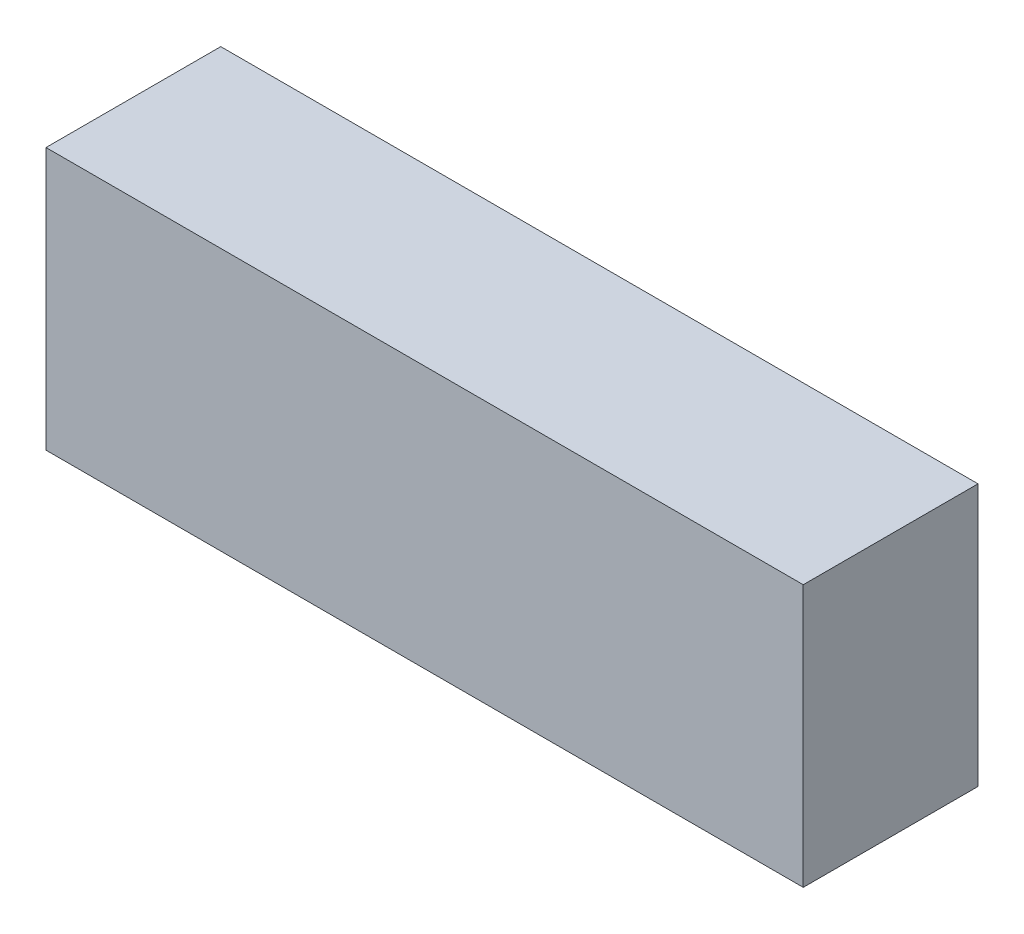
SolidWorks part; units mm, degrees
ref_plane "Plan de face" through (0, 0, 0) normal (0, 0, 1) x (1, 0, 0)
ref_plane "Plan de dessus" through (0, 0, 0) normal (0, 1, 0) x (1, 0, 0)
ref_plane "Plan de droite" through (0, 0, 0) normal (1, 0, 0) x (0, 0, -1)
sketch "Esquisse1" plane through (0, 0, 0) normal (0, 0, 1) x (1, 0, 0)
  line L1 (0, 0) -> (134, 0)
  line L2 (0, 0) -> (0, 50)
  line L3 (0, 50) -> (134, 50)
  line L4 (134, 0) -> (134, 50)
  dimension "D1" = 134
  dimension "D2" = 50
extrude "Extrusion1" add sketch "Esquisse1" along normal blind 30
sketch "Esquisse2" plane through (0, 50, 0) normal (0, 1, 0) x (1, 0, 0)
  line L1 (0, -30) -> (134, -30)
  line L2 (0, -30) -> (0, 0)
  line L3 (0, 0) -> (134, 0)
  line L4 (134, -30) -> (134, 0)
extrude "Enlèv. mat.-Extru.1" cut sketch "Esquisse2" against normal blind 5
sketch "Esquisse3" plane through (0, 0, 0) normal (-1, 0, 0) x (0, 0, 1)
  line L1 (30, 0) -> (0, 0)
  line L2 (30, 0) -> (30, 45)
  line L3 (30, 45) -> (0, 45)
  line L4 (0, 0) -> (0, 45)
extrude "Enlèv. mat.-Extru.2" cut sketch "Esquisse3" against normal blind 2
sketch "Esquisse4" plane through (134, 0, 0) normal (1, 0, 0) x (0, 0, -1)
  line L0 (-30, 45) -> (0, 45) construction
  line L1 (-30, 0) -> (0, 0)
  line L2 (-30, 0) -> (-30, 45)
  line L3 (-30, 45) -> (0, 45)
  line L4 (0, 0) -> (0, 45)
  line L5 (0, 0) -> (0, 45) construction
extrude "Enlèv. mat.-Extru.3" cut sketch "Esquisse4" against normal blind 2
sketch "Esquisse5" [suppressed] plane through (0, 0, 30) normal (0, 0, 1) x (1, 0, 0)
  line L0 (132, 14) -> (112, 14)
  line L1 (132, 45) -> (132, 0) construction
  line L2 (112, 14) -> (112, 0)
  line L3 (2, 0) -> (132, 0) construction
  line L4 (132, 14) -> (132, 0)
  line L5 (132, 0) -> (112, 0)
  dimension "D1" = 14
  dimension "D2" = 20
extrude "Enlèv. mat.-Extru.4" [suppressed] cut sketch "Esquisse5" against normal blind 10
fillet "Congé1" [suppressed] radius 10
sketch "Esquisse6" [suppressed] plane through (0, 0, 30) normal (0, 0, 1) x (1, 0, 0)
  line L0 (2, 19) -> (27, 19)
  line L1 (2, 0) -> (2, 45) construction
  line L2 (27, 19) -> (27, 30)
  line L3 (27, 30) -> (2, 30)
  line L4 (2, 30) -> (2, 19)
  line L5 (2, 45) -> (132, 45) construction
  dimension "D1" = 15
  dimension "D2" = 11
  dimension "D3" = 25
extrude "Enlèv. mat.-Extru.5" [suppressed] cut sketch "Esquisse6" against normal through all
fillet "Congé2" [suppressed] radius 5
fillet "Congé3" [suppressed] radius 5
hole_wizard "Diamètre du perçage Ø20.0 (20)1" positions "Esquisse8" profile "Esquisse7" hole size "Ø20.0" standard "ISO"
sketch "Esquisse8" plane through (0, 0, 30) normal (0, 0, 1) x (1, 0, 0)
  line L1 (2, 0) -> (112, 0) construction
  line L2 (2, 0) -> (2, 19) construction
  point P0 (75, 29)
  dimension "D1" = 29
  dimension "D2" = 73
sketch "Esquisse7" plane through (75, 29, 30) normal (1, 0, 0) x (0, -1, 0)
  line L0 (0, 0) -> (0, 30)
  line L1 (0, 30) -> (10, 30)
  line L2 (10, 30) -> (10, 0)
  line L5 (10, 0) -> (0, 0)
  line L11 (0, -6.35) -> (0, 107.95) construction
  dimension "Diamètre du perçage jusqu'au prochain" = 20
  dimension "Profondeur du perçage jusqu'au prochain" = 30
hole_wizard "Diamètre du perçage Ø10.0 (10)1" positions "Esquisse10" profile "Esquisse9" hole size "Ø10.0" standard "ISO"
sketch "Esquisse10" plane through (0, 0, 30) normal (0, 0, 1) x (1, 0, 0)
  line L0 (2, 0) -> (112, 0) construction
  circle A0 centre (75, 29) radius 10 construction
  point P0 (46, 29)
  point P6 (104, 29)
  dimension "D1" = 29
  dimension "D2" = 29
  dimension "D3" = 29
sketch "Esquisse9" plane through (46, 29, 30) normal (1, 0, 0) x (0, -1, 0)
  line L0 (0, 0) -> (0, 30)
  line L1 (0, 30) -> (5, 30)
  line L2 (5, 30) -> (5, 0)
  line L5 (5, 0) -> (0, 0)
  line L11 (0, -6.35) -> (0, 107.95) construction
  dimension "Diamètre du perçage jusqu'au prochain" = 10
  dimension "Profondeur du perçage jusqu'au prochain" = 30
hole_wizard "Diamètre du perçage Ø3.0 (3)1" positions "Esquisse12" profile "Esquisse11" hole size "Ø3.0" standard "ISO"
sketch "Esquisse12" plane through (0, 45, 0) normal (0, 1, 0) x (-1, 0, 0)
  line L1 (-132, 0) -> (-2, 0) construction
  line L2 (-2, 30) -> (-2, 0) construction
  point P0 (-75, 2.5)
  dimension "D1" = 73
  dimension "D2" = 2.5
sketch "Esquisse11" plane through (75, 45, 2.5) normal (1, 0, 0) x (0, 0, 1)
  line L0 (0, 0) -> (0, 40.9013)
  line L1 (0, 40.9013) -> (1.5, 40)
  line L2 (1.5, 40) -> (1.5, 0)
  line L5 (1.5, 0) -> (0, 0)
  line L10 (0, 40.9013) -> (-1.5, 40) construction
  line L11 (0, -6.35) -> (0, 107.95) construction
  dimension "Diamètre du perçage" = 3
  dimension "Profondeur du perçage" = 40
  dimension "Angle de pointe" = 118
hole_wizard "Perçage1" positions "Esquisse14" profile "Esquisse13" legacy
sketch "Esquisse14" plane through (0, 45, 0) normal (0, 1, 0) x (-1, 0, 0)
  line L0 (-2, 30) -> (-2, 0) construction
  line L1 (-132, 0) -> (-2, 0) construction
  point P0 (-35, 15)
  point P6 (-115, 15)
  dimension "D1" = 33
  dimension "D2" = 15
  dimension "D3" = 80
sketch "Esquisse13" plane through (35, 45, 15) normal (1, 0, 0) x (0, 0, 1)
  line L0 (0, 0) -> (0, 47.7039)
  line L1 (0, 47.7039) -> (4.5, 45)
  line L2 (4.5, 45) -> (4.5, 8.2)
  line L3 (4.5, 8.2) -> (7.5, 8.2)
  line L4 (7.5, 0) -> (0, 0)
  line L5 (0, -11.3109) -> (0, 121.1557) construction
  line L6 (0, 47.7039) -> (-4.5, 45) construction
  line L7 (7.5, 8.2) -> (7.5, 0)
  dimension "Diamètre" = 9
  dimension "Profondeur" = 45
  dimension "Diamètre chambrage" = 15
  dimension "Profondeur chambrage" = 8.2
  dimension "Angle" = 118
sketch "Esquisse15" [suppressed] plane through (0, 45, 0) normal (0, 1, 0) x (1, 0, 0)
  line L0 (2, -30) -> (2, 0) construction
  line L1 (106, -24.5) -> (44, -24.5)
  line L2 (106, -24.5) -> (106, -5.5)
  line L3 (106, -5.5) -> (44, -5.5)
  line L4 (44, -24.5) -> (44, -5.5)
  line L5 (132, 0) -> (2, 0) construction
  dimension "D1" = 62
  dimension "D2" = 42
  dimension "D3" = 19
  dimension "D4" = 5.5
extrude "Enlèv. mat.-Extru.6" [suppressed] cut sketch "Esquisse15" against normal through all
fillet "Congé4" [suppressed] radius 5
fillet "Congé5" [suppressed] radius 5
fillet "Congé6" [suppressed] radius 5
fillet "Congé7" [suppressed] radius 5
